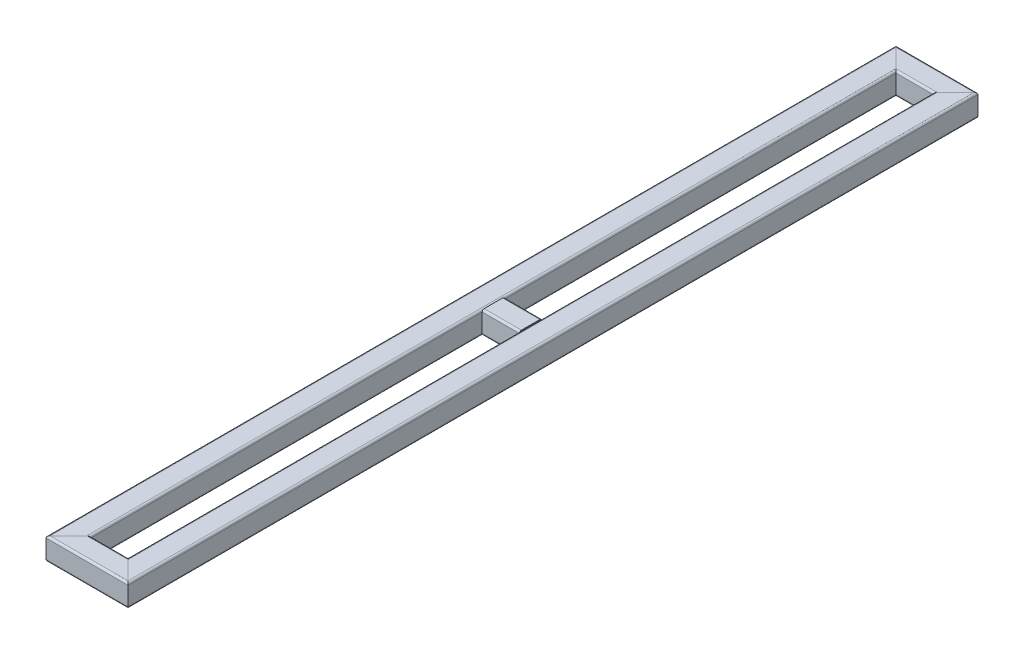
SolidWorks part; units mm, degrees
ref_plane "Plan de face" through (0, 0, 0) normal (0, 0, 1) x (1, 0, 0)
ref_plane "Plan de dessus" through (0, 0, 0) normal (0, 1, 0) x (1, 0, 0)
ref_plane "Plan de droite" through (0, 0, 0) normal (1, 0, 0) x (0, 0, -1)
sketch3d "Esquisse3D1"
  line L0 (0, 0, 0) -> (120, 0, 0)
  line L1 (120, 0, 0) -> (120, 0, -1665)
  line L2 (120, 0, -1665) -> (0, 0, -1665)
  line L3 (0, 0, -1665) -> (0, 0, 0)
  line L4 (0, 0, -832.5) -> (120, 0, -832.5)
  dimension "D1" = 120
  dimension "D2" = 1665
other "Elément mécano-soudé1"
ref_plane "Plan1" through (0, 0, -1665) normal (0, 0, 1) x (1, 0, 0)
sketch "Sketch11" plane through (0, 0, -1665) normal (0, 0, 1) x (1, 0, 0)
  line L0 (-18.5, -20.5) -> (18.5, -20.5)
  line L1 (-20.5, -18.5) -> (-20.5, 18.5)
  line L2 (18.5, 20.5) -> (-18.5, 20.5)
  line L3 (20.5, 18.5) -> (20.5, -18.5)
  line L4 (-18.5, -22.5) -> (18.5, -22.5)
  line L5 (-22.5, -18.5) -> (-22.5, 18.5)
  line L6 (18.5, 22.5) -> (-18.5, 22.5)
  line L7 (22.5, 18.5) -> (22.5, -18.5)
  arc A0 (22.5, 18.5) -> (18.5, 22.5) centre (18.5, 18.5) ccw
  arc A1 (18.5, -22.5) -> (22.5, -18.5) centre (18.5, -18.5) ccw
  arc A2 (-22.5, -18.5) -> (-18.5, -22.5) centre (-18.5, -18.5) ccw
  arc A3 (-18.5, 22.5) -> (-22.5, 18.5) centre (-18.5, 18.5) ccw
  arc A4 (-18.5, 20.5) -> (-20.5, 18.5) centre (-18.5, 18.5) ccw
  arc A5 (20.5, 18.5) -> (18.5, 20.5) centre (18.5, 18.5) ccw
  arc A6 (18.5, -20.5) -> (20.5, -18.5) centre (18.5, -18.5) ccw
  arc A7 (-20.5, -18.5) -> (-18.5, -20.5) centre (-18.5, -18.5) ccw
  point P0 (-22.5, 0)
  point P1 (22.5, 0)
  point P2 (0, 22.5)
  point P3 (0, -22.5)
  point P4 (0, 0)
  point P5 (-22.5, -22.5)
  point P6 (22.5, -22.5)
  point P7 (22.5, 22.5)
  point P8 (-22.5, 22.5)
  point P33 (0, 0)
  dimension "D1" = 4
  dimension "Thickness" = 2
  dimension "V_leg" = 45
